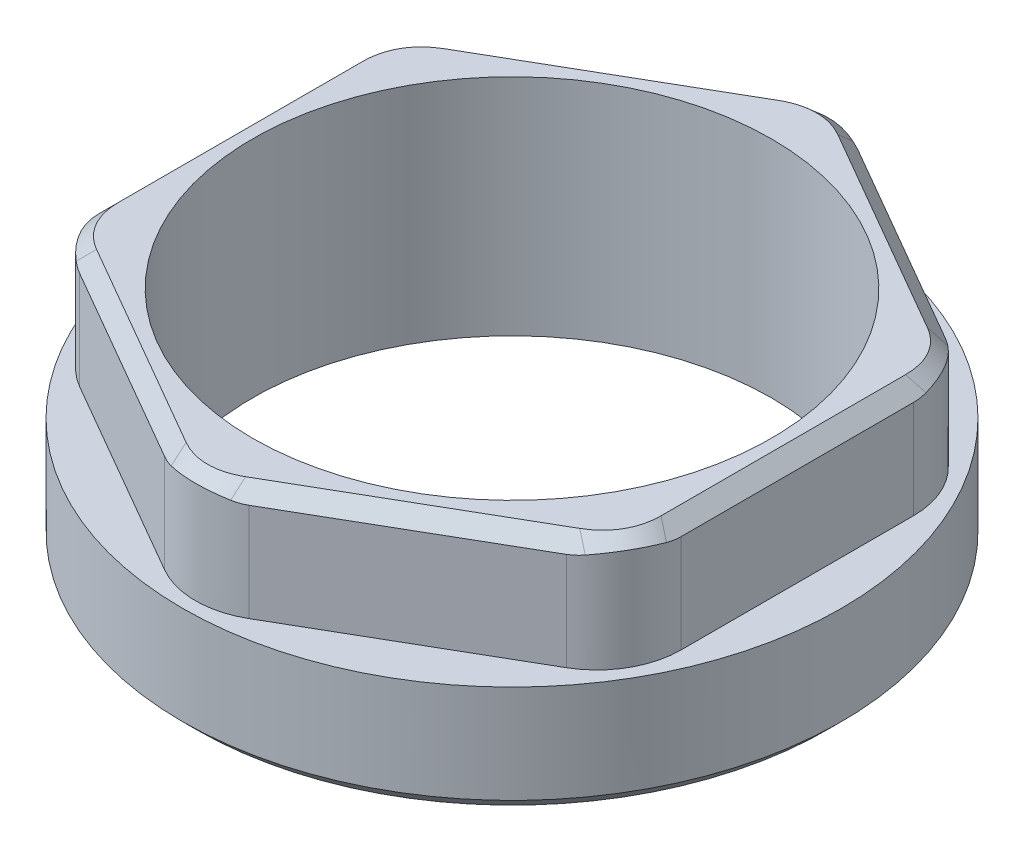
SolidWorks part; units mm, degrees
ref_plane "前视基准面" through (0, 0, 0) normal (0, 0, 1) x (1, 0, 0)
ref_plane "上视基准面" through (0, 0, 0) normal (0, 1, 0) x (1, 0, 0)
ref_plane "右视基准面" through (0, 0, 0) normal (1, 0, 0) x (0, 0, -1)
sketch "草图1" plane through (0, 0, 0) normal (0, 1, 0) x (1, 0, 0)
  circle A0 centre (0, 0) radius 11.75
  circle A1 centre (0, 0) radius 9.25
  dimension "D1" = 23.5
  dimension "D2" = 18.5
extrude "凸台-拉伸1" add sketch "草图1" along normal blind 4
sketch "草图2" plane through (0, 4, 0) normal (0, 1, 0) x (1, 0, 0)
  line L0 (0, 11.75) -> (0, -11.75) construction
  line L1 (0, 0) -> (10.1758, 5.875) construction
  line L2 (0, 0) -> (10.1758, -5.875) construction
  line L3 (0, 0) -> (-10.1758, -5.875) construction
  line L4 (0, 0) -> (-10.1758, 5.875) construction
  line L5 (0, 11.75) -> (-10.1758, 5.875)
  line L6 (-10.1758, 5.875) -> (-10.1758, -5.875)
  line L7 (-10.1758, -5.875) -> (0, -11.75)
  line L8 (0, -11.75) -> (10.1758, -5.875)
  line L9 (10.1758, -5.875) -> (10.1758, 5.875)
  line L10 (10.1758, 5.875) -> (0, 11.75)
  circle A0 centre (0, 0) radius 9.25
  circle A1 centre (0, 0) radius 11.75 construction
  dimension "D1" = 60
  dimension "D2" = 60
extrude "凸台-拉伸2" add sketch "草图2" along normal blind 4
chamfer "倒角1" distance 0.5 angle 45 7 edges at (-10.1758, 8, 0) (-5.0879, 8, -8.8125) (5.0879, 8, -8.8125) (10.1758, 8, 0) (5.0879, 8, 8.8125) (-5.0879, 8, 8.8125) (0, 0, 11.75)
fillet "圆角1" radius 3 12 edges at (10.1758, 5.75, -5.875) (9.9258, 7.75, -5.7307) (0, 7.75, 11.4613) (0, 5.75, 11.75) (-10.1758, 5.75, 5.875) (-9.9258, 7.75, 5.7307) (-10.1758, 5.75, -5.875) (-9.9258, 7.75, -5.7307) (0, 5.75, -11.75) (0, 7.75, -11.4613) (10.1758, 5.75, 5.875) (9.9258, 7.75, 5.7307)
